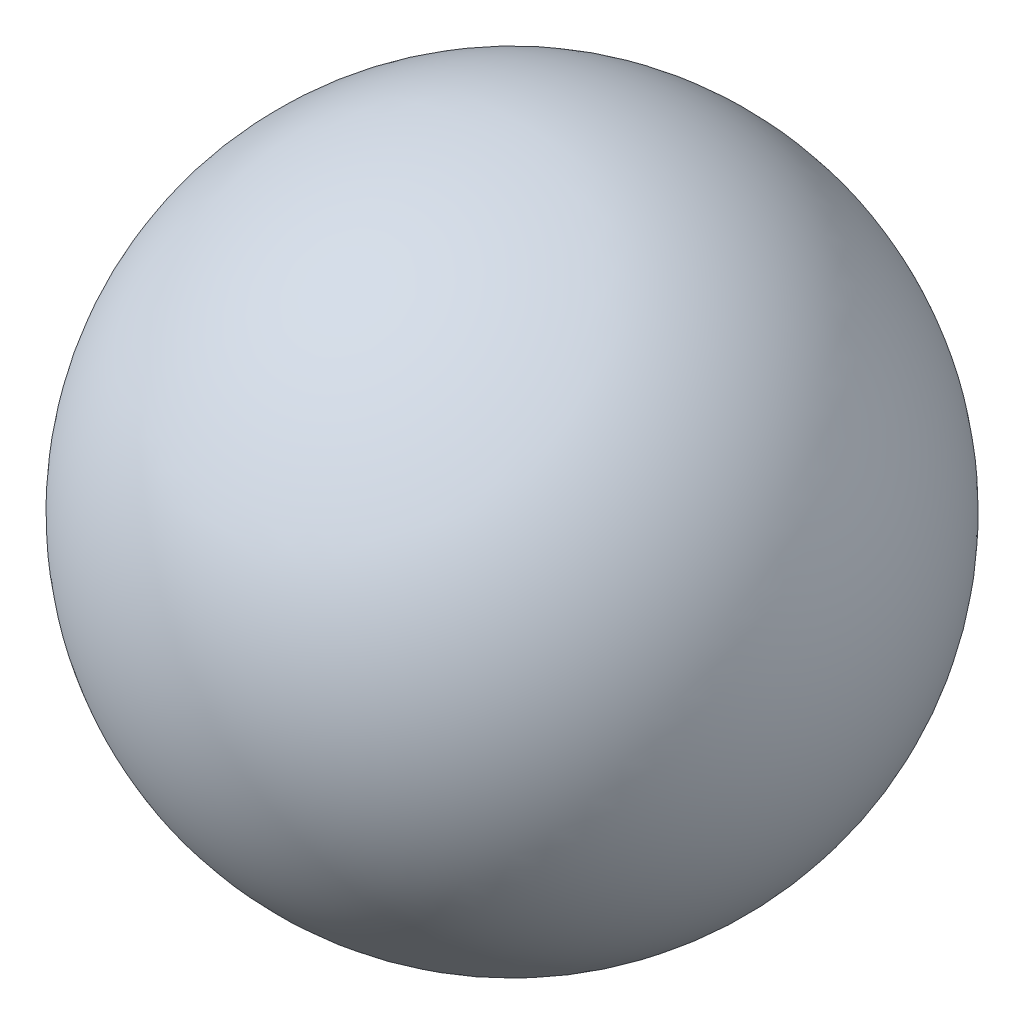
SolidWorks part; units mm, degrees
ref_plane "Front Plane" through (0, 0, 0) normal (0, 0, 1) x (1, 0, 0)
ref_plane "Top Plane" through (0, 0, 0) normal (0, 1, 0) x (1, 0, 0)
ref_plane "Right Plane" through (0, 0, 0) normal (1, 0, 0) x (0, 0, -1)
sketch "Sketch1" plane through (0, 0, 0) normal (0, 1, 0) x (1, 0, 0)
  line L0 (0, -14.7405) -> (0, 14.7405) construction
  line L1 (0, -14.7405) -> (0, 14.7405)
  arc A0 (0, 14.7405) -> (0, -14.7405) centre (0, 0) ccw
  point P1 (0, -22.083)
  point P5 (0, 14.7405)
revolve "Revolve1" add sketch "Sketch1" angle 360 about L0
